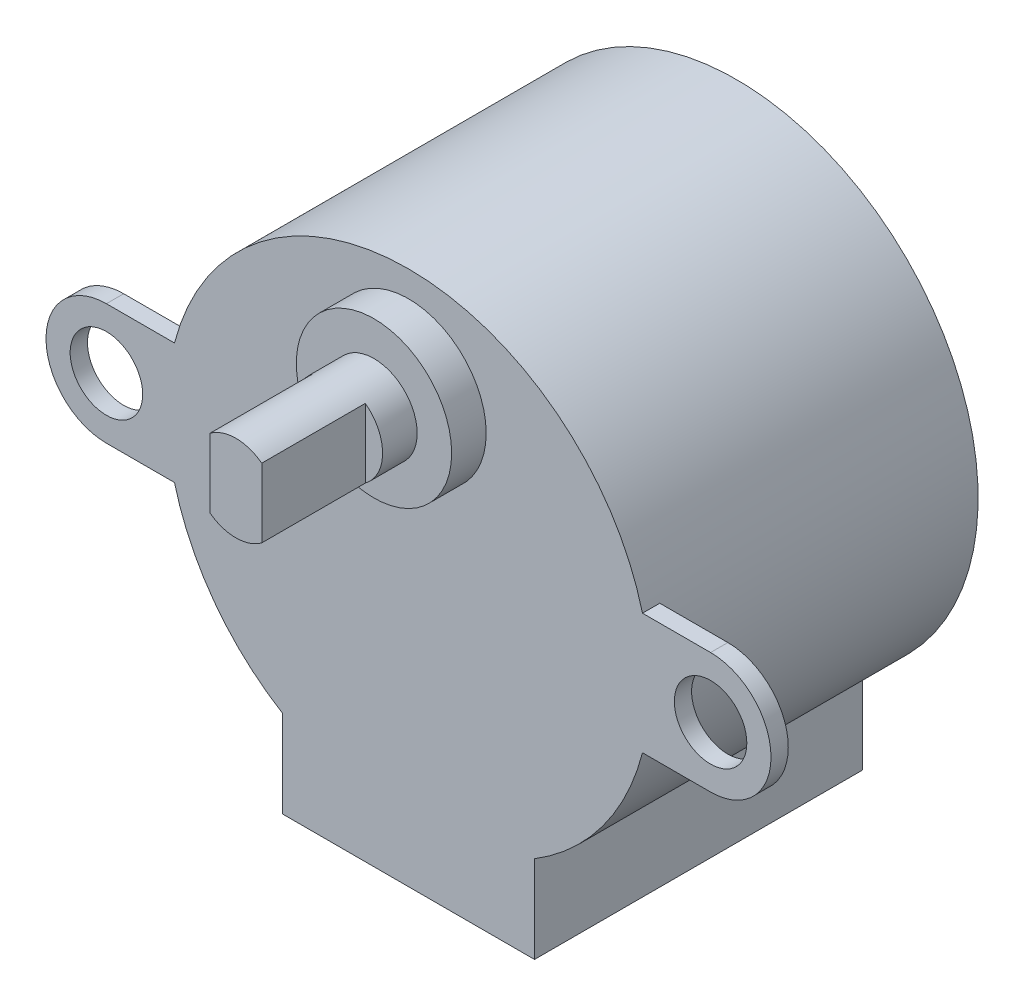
SolidWorks part; units mm, degrees
ref_plane "Front Plane" through (0, 0, 0) normal (0, 0, 1) x (1, 0, 0)
ref_plane "Top Plane" through (0, 0, 0) normal (0, 1, 0) x (1, 0, 0)
ref_plane "Right Plane" through (0, 0, 0) normal (1, 0, 0) x (0, 0, -1)
sketch "Эскиз1" plane through (0, 0, 0) normal (0, 0, 1) x (1, 0, 0)
  line L0 (0, 0) -> (0, 8) construction
  line L1 (17.5, 0) -> (-17.5, 0) construction
  line L2 (-17.5, 3.5) -> (17.5, 3.5) construction
  line L3 (-17.5, -3.5) -> (17.5, -3.5) construction
  line L4 (-17.5, 3.5) -> (-13.5554, 3.5)
  line L5 (17.5, 3.5) -> (13.5554, 3.5)
  line L6 (0, 8) -> (0, 14) construction
  line L7 (-17.5, 3.5) -> (-17.5, -3.5) construction
  line L8 (17.5, 3.5) -> (17.5, -3.5) construction
  line L9 (0, 0) -> (0, -17) construction
  line L10 (-7.3, -17) -> (7.3, -17)
  line L11 (-7.3, -17) -> (-7.3, -11.9461)
  line L12 (7.3, -17) -> (7.3, -11.9461)
  line L13 (-17.5, -3.5) -> (-13.5554, -3.5)
  line L14 (13.5554, -3.5) -> (17.5, -3.5)
  circle A0 centre (17.5, 0) radius 2.1
  circle A1 centre (-17.5, 0) radius 2.1
  arc A2 (17.5, 3.5) -> (17.5, -3.5) centre (17.5, 0) cw
  arc A3 (-17.5, 3.5) -> (-17.5, -3.5) centre (-17.5, 0) ccw
  arc A4 (-13.5554, 3.5) -> (13.5554, 3.5) centre (0, 0) cw
  circle A5 centre (0, 0) radius 14 construction
  arc A6 (-7.3, -11.9461) -> (-13.5554, -3.5) centre (0, 0) cw
  arc A7 (13.5554, -3.5) -> (7.3, -11.9461) centre (0, 0) cw
  point P6 (0, 0)
  point P20 (0, -17)
  dimension "D2" = 4.2
  dimension "D5" = 6
  dimension "D1" = 35
  dimension "D3" = 3.5
  dimension "D4" = 3.5
  dimension "D6" = 8
  dimension "D7" = 17
  dimension "D8" = 14.6
extrude "Бобышка-Вытянуть1" add sketch "Эскиз1" along normal blind 1
sketch "Эскиз2" plane through (0, 0, 1) normal (0, 0, 1) x (1, 0, 0)
  line L0 (-7.3, -11.9461) -> (-7.3, -17)
  line L1 (-7.3, -17) -> (7.3, -17)
  line L2 (7.3, -17) -> (7.3, -11.9461)
  arc A0 (7.3, -11.9461) -> (-7.3, -11.9461) centre (0, 0) ccw
extrude "Бобышка-Вытянуть2" add sketch "Эскиз2" against normal blind 19
sketch "Эскиз3" plane through (0, 0, 1) normal (0, 0, 1) x (1, 0, 0)
  circle A0 centre (0, 8) radius 4.5
  dimension "D1" = 9
extrude "Бобышка-Вытянуть3" add sketch "Эскиз3" along normal blind 2
sketch "Эскиз4" plane through (0, 0, 3) normal (0, 0, 1) x (1, 0, 0)
  circle A0 centre (0, 8) radius 2.5
  dimension "D1" = 5
extrude "Бобышка-Вытянуть4" add sketch "Эскиз4" along normal blind 2
sketch "Эскиз5" plane through (0, 0, 5) normal (0, 0, 1) x (1, 0, 0)
  line L0 (0, 10.5) -> (0, 5.5) construction
  line L1 (-1.5, 10) -> (-1.5, 6)
  line L2 (1.5, 10) -> (1.5, 6)
  circle A2 centre (0, 8) radius 2.5 construction
  circle A3 centre (0, 8) radius 2.5 construction
  arc A4 (-1.5, 10) -> (1.5, 10) centre (0, 8) cw
  arc A5 (1.5, 6) -> (-1.4992, 5.9994) centre (0, 8) cw
  circle A6 centre (0, 8) radius 2.5 construction
  dimension "D1" = 3
extrude "Бобышка-Вытянуть5" add sketch "Эскиз5" along normal blind 6 contours L2 L1 M5
